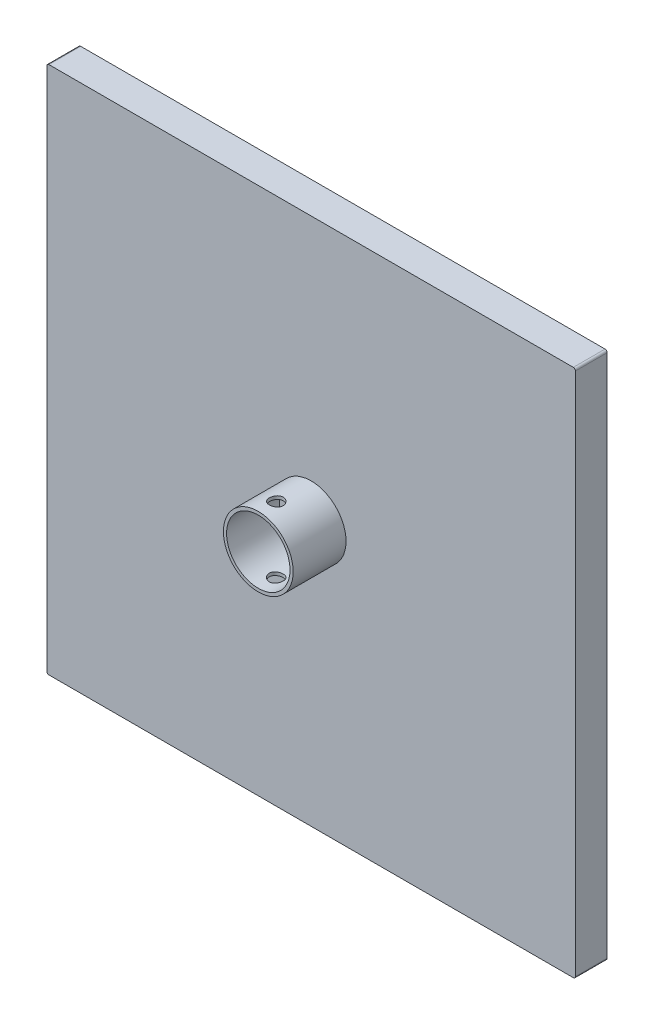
SolidWorks part; units mm, degrees
ref_plane "Plan de face" through (0, 0, 0) normal (0, 0, 1) x (1, 0, 0)
ref_plane "Plan de dessus" through (0, 0, 0) normal (0, 1, 0) x (1, 0, 0)
ref_plane "Plan de droite" through (0, 0, 0) normal (1, 0, 0) x (0, 0, -1)
sketch "Esquisse1" plane through (0, 0, 0) normal (0, 0, 1) x (1, 0, 0)
  line L1 (-250, 250) -> (250, 250)
  line L2 (-250, 250) -> (-250, -250)
  line L3 (-250, -250) -> (250, -250)
  line L4 (250, 250) -> (250, -250)
  line L5 (-250, 250) -> (250, -250) construction
  line L6 (-250, -250) -> (250, 250) construction
  point P0 (0, 0)
  dimension "D1" = 500
  dimension "D2" = 500
extrude "Boss.-Extru.1" add sketch "Esquisse1" along normal blind 30
sketch "Esquisse2" plane through (0, 0, 30) normal (0, 0, 1) x (1, 0, 0)
  line L0 (250, 250) -> (-250, -250) construction
  circle A0 centre (0, 0) radius 33
  circle A1 centre (0, 0) radius 30
  dimension "D1" = 60
  dimension "D2" = 66
extrude "Boss.-Extru.2" add sketch "Esquisse2" along normal blind 50
ref_plane "Plan1" through (0, 0, 0) normal (-0.7071, 0.7071, 0) x (0, 0, 1)
sketch "Esquisse5" plane through (0, 0, 0) normal (0, 1, 0) x (1, 0, 0)
  line L0 (-33, -80) -> (33, -80) construction
  circle A0 centre (0, -63) radius 6.5
  dimension "D1" = 13
  dimension "D2" = 17
extrude "Enlèv. mat.-Extru.2" cut sketch "Esquisse5" against normal blind 50 and the other way blind 50
ref_plane "Plan2" through (0, 0, 0) normal (-1, 0, 0) x (0, 0, 1)
ref_plane "Plan3" through (0, 0, 0) normal (0, 1, 0) x (1, 0, 0)
sketch "Esquisse7" plane through (0, 0, 30) normal (0, 0, 1) x (1, 0, 0)
  line L0 (-250, 250) -> (250, -250)
  line L1 (250, 250) -> (-250, -250)
fillet "Congé1" radius 2 4 edges at (250, -250, 15) (-250, -250, 15) (250, 250, 15) (-250, 250, 15)
